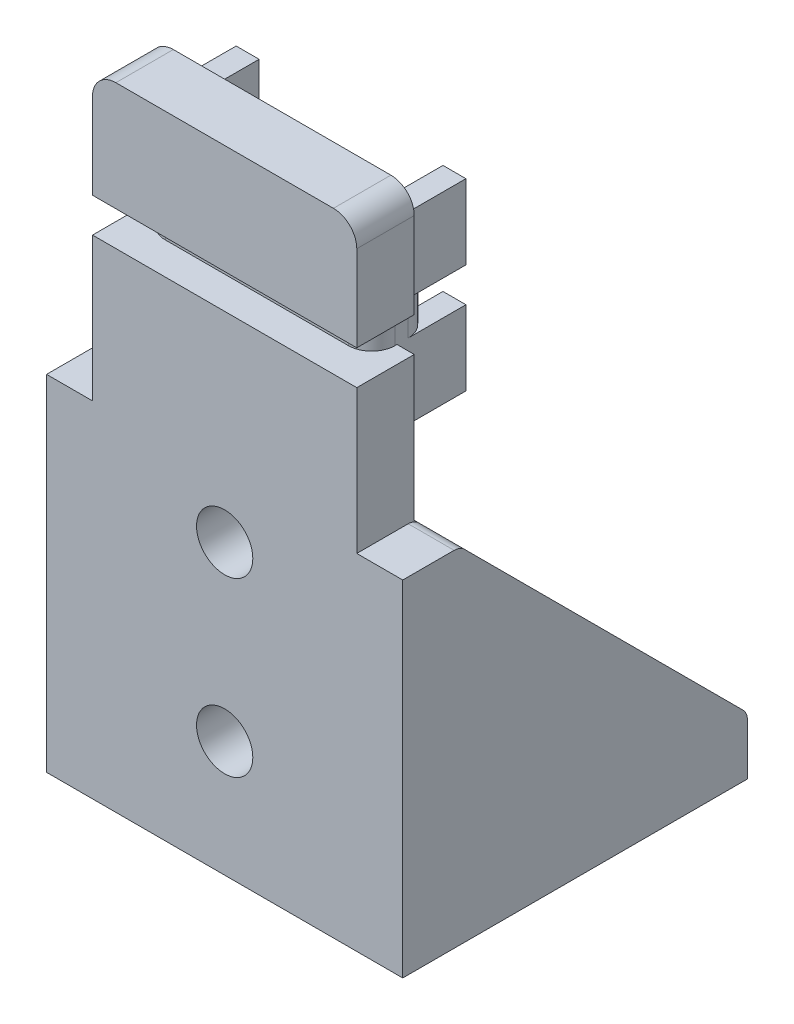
SolidWorks part; units mm, degrees
ref_plane "Front Plane" through (0, 0, 0) normal (0, 0, 1) x (1, 0, 0)
ref_plane "Top Plane" through (0, 0, 0) normal (0, 1, 0) x (1, 0, 0)
ref_plane "Right Plane" through (0, 0, 0) normal (1, 0, 0) x (0, 0, -1)
sketch "Sketch1" plane through (0, 0, 0) normal (0, 0, 1) x (1, 0, 0)
  line L1 (-11.5, -25) -> (11.5, -25)
  line L2 (-11.5, -25) -> (-11.5, 25)
  line L3 (-11.5, 25) -> (11.5, 25)
  line L4 (11.5, -25) -> (11.5, 25)
  line L5 (-11.5, -25) -> (11.5, 25) construction
  line L6 (-11.5, 25) -> (11.5, -25) construction
  circle A0 centre (0, -4.906) radius 2.45
  circle A1 centre (0, -19.906) radius 2.45
  point P0 (0, 0)
  dimension "D3" = 4.9
  dimension "D4" = 5.094
  dimension "D5" = 2
  dimension "D6" = 15
  dimension "D1" = 23
  dimension "D2" = 50
extrude "Boss-Extrude1" add sketch "Sketch1" along normal blind 5
sketch "Sketch3" plane through (0, -25, 0) normal (0, -1, 0) x (1, 0, 0)
  line L1 (-15.5, -25) -> (15.5, -25)
  line L2 (-15.5, -25) -> (-15.5, 5)
  line L3 (-15.5, 5) -> (15.5, 5)
  line L4 (15.5, -25) -> (15.5, 5)
  line L5 (-15.5, -25) -> (15.5, 5) construction
  line L6 (-15.5, 5) -> (15.5, -25) construction
  circle A0 centre (7.5, -17.5) radius 2.5
  circle A1 centre (-7.5, -17.5) radius 2.5
  dimension "D3" = 5
  dimension "D4" = 7.5
  dimension "D8" = 8
  dimension "D9" = 15
  dimension "D1" = 8
  dimension "D2" = 30
  dimension "D6" = 31
  dimension "D7" = 2
extrude "Boss-Extrude2" add sketch "Sketch3" along normal blind 5
sketch "Sketch5" plane through (15.5, 0, 0) normal (1, 0, 0) x (0, 0, -1)
  line L0 (25, -25) -> (0, 0)
  line L1 (0, 0) -> (-5, 0)
  line L2 (-5, 0) -> (-5, -25)
  line L3 (-5, -25) -> (25, -25)
  line L4 (-5, -25) -> (-5, 25) construction
  line L5 (0, -25) -> (0, 25) construction
  dimension "D1" = 45
extrude "Boss-Extrude3" add sketch "Sketch5" against normal blind 4
pattern_linear "LPattern1" count 2 spacing 27 along (-1, 0, 0) of "Boss-Extrude3"
fillet "Fillet1" radius 2.54 5 edges at (-11.5, -25, -12.5) (11.5, -25, -12.5) (-11.5, -12.5, 0) (0, -25, 0) (11.5, -12.5, 0)
sketch "Sketch6" plane through (0, 0, 0) normal (0, 0, -1) x (-1, 0, 0)
  circle A0 centre (0, -19.906) radius 5.094
extrude "Cut-Extrude1" cut sketch "Sketch6" along normal blind 4
sketch "Sketch4" plane through (0, -25, 0) normal (0, 1, 0) x (1, 0, 0)
  circle A0 centre (7.5, 17.5) radius 5.5
  circle A1 centre (-7.486, 17.5) radius 5.5
  dimension "D1" = 2
  dimension "D2" = 11
extrude "Cut-Extrude2" cut sketch "Sketch4" along normal blind 14.16
sketch "Sketch7" plane through (0, -30, 0) normal (0, -1, 0) x (1, 0, 0)
  circle A0 centre (7.5, -17.5) radius 5
  circle A1 centre (7.5, -17.5) radius 2.5
  circle A2 centre (-7.486, -17.5) radius 5
  circle A3 centre (-7.486, -17.5) radius 2.5
  dimension "D1" = 10
  dimension "D2" = 2
extrude "Boss-Extrude4" add sketch "Sketch7" along normal blind 2
sketch "Sketch8" plane through (0, 0, 0) normal (0, 0, -1) x (-1, 0, 0)
  line L1 (10, 22) -> (-10, 22)
  line L2 (10, 22) -> (10, 6)
  line L3 (10, 6) -> (-10, 6)
  line L4 (-10, 22) -> (-10, 6)
  line L5 (10, 22) -> (-10, 6) construction
  line L6 (10, 6) -> (-10, 22) construction
  line L9 (-11.5, 25) -> (11.5, 25) construction
  point P0 (0, 14)
  dimension "D1" = 20
  dimension "D2" = 16
  dimension "D3" = 3
extrude "PCB Island Boss-Extrude5" add sketch "Sketch8" along normal blind 2
sketch "Sketch9" plane through (0, 0, -2) normal (0, 0, -1) x (-1, 0, 0)
  line L0 (-10, 6) -> (10, 6) construction
  line L1 (10, 22) -> (8, 22)
  line L2 (10, 22) -> (10, 6)
  line L3 (10, 6) -> (8, 6)
  line L4 (8, 22) -> (8, 6)
  line L6 (-10, 22) -> (-8, 22)
  line L7 (-10, 22) -> (-10, 6)
  line L8 (-10, 6) -> (-8, 6)
  line L9 (-8, 22) -> (-8, 6)
  dimension "D1" = 2
  dimension "D2" = 2
extrude "Boss-Extrude6" add sketch "Sketch9" along normal blind 4
sketch "Sketch10" plane through (-11.5, 0, 0) normal (-1, 0, 0) x (0, 0, 1)
  line L1 (2.2, 12.5) -> (5.2, 12.5)
  line L2 (2.2, 12.5) -> (2.2, 15.5)
  line L3 (2.2, 15.5) -> (5.2, 15.5)
  line L4 (5.2, 12.5) -> (5.2, 15.5)
  line L5 (2.2, 12.5) -> (5.2, 15.5) construction
  line L6 (2.2, 15.5) -> (5.2, 12.5) construction
  line L8 (5, 25) -> (0, 25) construction
  line L9 (5, 25) -> (5, 0) construction
  point P0 (3.7, 14)
  dimension "D1" = 3
  dimension "D2" = 3
  dimension "D3" = 1.3
  dimension "D4" = 11
extrude "TyWrap Slot Cut-Extrude3" cut sketch "Sketch10" against normal through all
fillet "Fillet3" radius 1.27 2 edges at (0, 6, 0) (0, 22, 0)
chamfer "Chamfer1" distance 2.54 angle 45 2 edges at (7.5, -30, -12.5) (-7.486, -30, -12.5)
fillet "Fillet5" radius 1.27 5 edges at (0, -25, -25) (-12.23, -25, -25) (12.23, -25, -25) (13.5, 0, 0) (-13.5, 0, 0)
sketch "Sketch11" plane through (0, 0, 5) normal (0, 0, 1) x (1, 0, 0)
  line L0 (-11.5, 15.5) -> (11.5, 15.5) construction
  line L1 (-10, 15.5) -> (-12.2454, 15.5)
  line L2 (-10, 15.5) -> (-10, 12.5)
  line L3 (-10, 12.5) -> (-12.2454, 12.5)
  line L4 (-12.2454, 15.5) -> (-12.2454, 12.5)
  line L5 (-10, 4.73) -> (-10, 23.27) construction
  line L6 (11.5, 12.5) -> (-11.5, 12.5) construction
  line L7 (12.0145, 15.5) -> (10, 15.5)
  line L8 (12.0145, 15.5) -> (12.0145, 12.5)
  line L9 (12.0145, 12.5) -> (10, 12.5)
  line L10 (10, 15.5) -> (10, 12.5)
  line L11 (10, 23.27) -> (10, 4.73) construction
  line L12 (10, 23.27) -> (10, 4.73) construction
  line L13 (-10, 4.73) -> (-10, 23.27) construction
extrude "Cut-Extrude4" cut sketch "Sketch11" against normal through all
fillet "Fillet7" radius 2.032 2 edges at (-10, 14, 2.2) (10, 14, 2.2)
fillet "Fillet8" radius 2.032 2 edges at (11.5, 25, 2.5) (-11.5, 25, 2.5)
sketch "Sketch12" plane through (0, 0, -6) normal (0, 0, -1) x (-1, 0, 0)
  line L1 (-10, 22) -> (-7, 22)
  line L2 (-10, 22) -> (-10, 6)
  line L3 (-10, 6) -> (-7, 6)
  line L4 (-7, 22) -> (-7, 6)
  line L5 (10, 6) -> (6.5, 6)
  line L6 (10, 6) -> (10, 22)
  line L7 (10, 22) -> (6.5, 22)
  line L8 (6.5, 6) -> (6.5, 22)
  dimension "D1" = 3
  dimension "D2" = 3.5
extrude "Boss-Extrude7" [suppressed] add sketch "Sketch12" against normal blind 2
fillet "Fillet9" [suppressed] radius 1.27
sketch "Sketch13" plane through (0, 0, -6) normal (0, 0, -1) x (-1, 0, 0)
  line L1 (-10, 15.5) -> (10, 15.5)
  line L2 (-10, 15.5) -> (-10, 12.5)
  line L3 (-10, 12.5) -> (10, 12.5)
  line L4 (10, 15.5) -> (10, 12.5)
extrude "Cut-Extrude5" cut sketch "Sketch13" against normal blind 3
fillet "Fillet10" radius 2.032 2 edges at (-10, 14, -3) (10, 14, -3)
